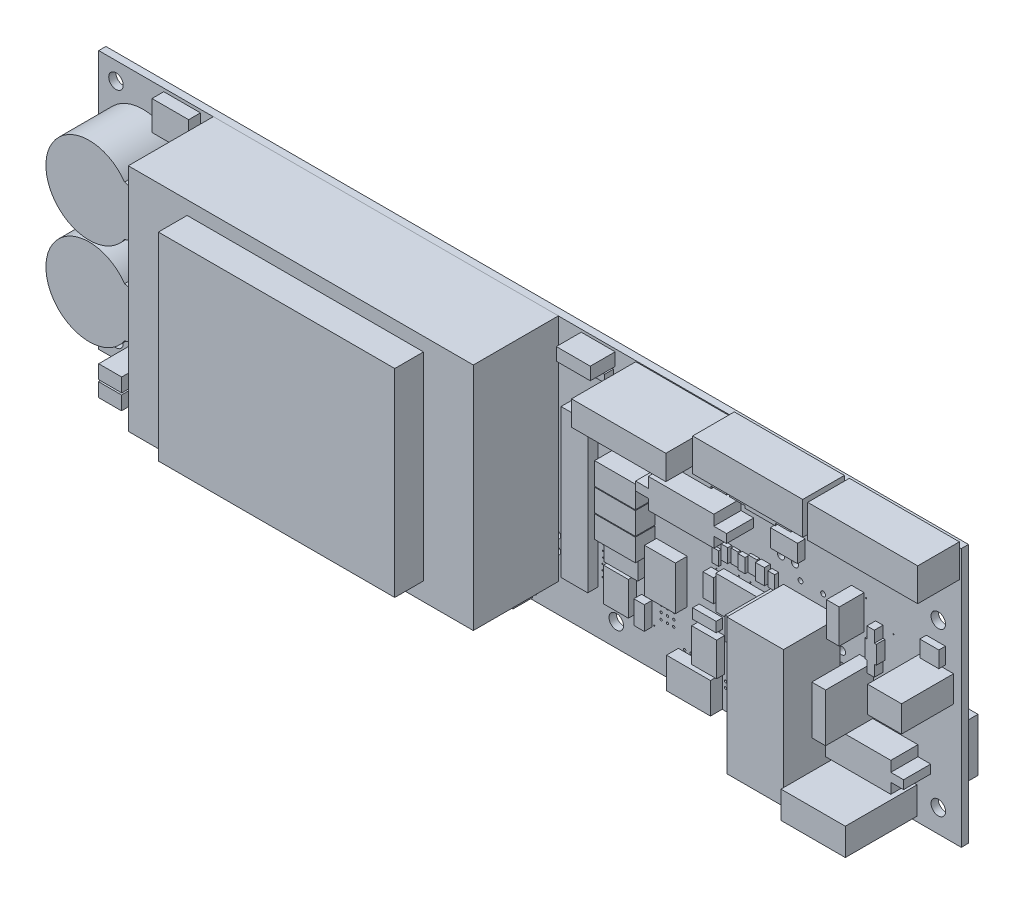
SolidWorks part; units mm, degrees
ref_plane "Front Plane" through (0, 0, 0) normal (0, 0, 1) x (1, 0, 0)
ref_plane "Top Plane" through (0, 0, 0) normal (0, 1, 0) x (1, 0, 0)
ref_plane "Right Plane" through (0, 0, 0) normal (1, 0, 0) x (0, 0, -1)
imported_body "10020446_model8_system_controller-1-solid1"
imported_body "SENSOR_SHT15_SHT11_0_SENSOR_SHT15_SHT15-1-solid1"
imported_body "IND_DO5022P_INDUCTOR_IND_DO5022P_33UH-1-solid1"
imported_body "IND_DO5022P_INDUCTOR_IND_DO5022P_15UH-1-solid1"
imported_body "TATTLETALE_TT8V2_HEADER 110_0_TATTLETALE_TT8V2_-1-solid1"
imported_body "DIOMELF3515N_SOD80_DIODE SCHOTTKY_DIOMELF3515N_SOD-1-solid1"
imported_body "DIOMELF3515N_SOD80_DIODE ZENER_DIOMELF3515N_SOD80_-1-solid1"
imported_body "DIOM7959X262N_DIODE SCHOTTKY_DIOM7959X262N_MB-1-solid1"
imported_body "DIOM7959X262N_DIODE SCHOTTKY_DIOM7959X262N_MB-2-solid1"
imported_body "DIOM7959X262N_DIODE SCHOTTKY_DIOM7959X262N_MB-3-solid1"
imported_body "SOD3717X145N_SOD123_DIODE SCHOTTKY_SOD3717X145N_SOD-1-solid1"
imported_body "SOD3717X145N_SOD123_DIODE SCHOTTKY_SOD3717X145N_SOD-2-solid1"
imported_body "SOD3717X145N_SOD123_DIODE SCHOTTKY_SOD3717X145N_SOD-3-solid1"
imported_body "SAMTEC_CLP12502XD_HEADER 25X2_SAMTEC_CLP12502X-1-solid1"
imported_body "CAPPRD500W80D1250H3000P_HORZ_CAP_CAPPRD500W80D1250H3000P_HOR-1-solid1"
imported_body "RESAD730W47L350D192P_R_RESAD730W47L350D192P_470-1-solid1"
imported_body "RESAD730W47L350D192P_R_RESAD730W47L350D192P_20K-1-solid1"
imported_body "RESAD730W47L350D192P_R_RESAD730W47L350D192P_2K-1-solid1"
imported_body "RESAD730W47L350D192P_R_RESAD730W47L350D192P_2K-2-solid1"
imported_body "RESAD730W47L350D192P_R_RESAD730W47L350D192P_22-1-solid1"
imported_body "RESAD730W47L350D192P_R_RESAD730W47L350D192P_22-2-solid1"
imported_body "RESAD730W47L350D192P_R_RESAD730W47L350D192P_475K-1-solid1"
imported_body "AMP_1034145_HEADER 7_AMP_1034145_AMPMODU_7-1-solid1"
imported_body "SOT95P280X1455N_DBV_MAX6340_SOT95P280X1455N_DBV_MA-1-solid1"
imported_body "SOT95P280X1455N_DBV_74LVC1G79_0_SOT95P280X1455N_DB-1-solid1"
imported_body "SOT190P229X1194N_MAX836_SOT190P229X1194N_MAX836-1-solid1"
imported_body "SOP65P491X1108N_UMAX8_MAX4172_SOP65P491X1108N_UMAX8_-1-solid1"
imported_body "SOT230P700X1804N_LT1121_0_SOT230P700X1804N_LT11-1-solid1"
imported_body "SOT65P280X1008_TS8_MAX6371_SOT65P280X1008_TS8_MAX-1-solid1"
imported_body "DALLASSEMI_DS9094_DS1996_DALLASSEMI_DS9094_DS199-1-solid1"
imported_body "DALLASSEMI_DS9094_DS1994LF5_DALLASSEMI_DS9094_D-1-solid1"
imported_body "TO170P1394X4576N_DD_LT1529_0_TO170P1394X4576N_DD_L-1-solid1"
imported_body "SOIC127P600X17516N_SOIC16_LTC1625_SOIC127P600X17516N_SOI-1-solid1"
imported_body "SOIC127P600X17516N_SOIC16_LTC1625_SOIC127P600X17516N_SOI-2-solid1"
imported_body "SW_FSM2JSMA_SW PUSHBUTTON_SW_FSM2JSMA_FSM2J-1-solid1"
imported_body "SW_FSM2JSMA_SW PUSHBUTTON_SW_FSM2JSMA_FSM2J-2-solid1"
imported_body "SW_FSM2JSMA_SW PUSHBUTTON_SW_FSM2JSMA_FSM2J-3-solid1"
imported_body "SW_FSM2JSMA_SW PUSHBUTTON_SW_FSM2JSMA_FSM2J-4-solid1"
imported_body "RESAD1160W64L616D239P_R_RESAD1160W64L616D239P_887-1-solid1"
imported_body "RESAD1160W64L616D239P_R_RESAD1160W64L616D239P_427K-1-solid1"
imported_body "SENS_CADDOCK_SR10_R_0_SENS_CADDOCK_SR10_001-1-solid1"
imported_body "RESC2013X60N_0805_R_RESC2013X60N_0805_1M-1-solid1"
imported_body "RESC2013X60N_0805_R_RESC2013X60N_0805_1M-2-solid1"
imported_body "RESC2013X60N_0805_R_RESC2013X60N_0805_1M-3-solid1"
imported_body "RESC2013X60N_0805_R_RESC2013X60N_0805_10K-1-solid1"
imported_body "RESC2013X60N_0805_R_RESC2013X60N_0805_10K-2-solid1"
imported_body "RESC2013X60N_0805_R_RESC2013X60N_0805_10K-3-solid1"
imported_body "RESC2013X60N_0805_R_RESC2013X60N_0805_10K-4-solid1"
imported_body "RESC2013X60N_0805_R_RESC2013X60N_0805_100K-1-solid1"
imported_body "RESC2013X60N_0805_R_RESC2013X60N_0805_100K-2-solid1"
imported_body "RESC1608X55N_0603_R_RESC1608X55N_0603_357K-1-solid1"
imported_body "RESC1608X55N_0603_R_RESC1608X55N_0603_392K-1-solid1"
imported_body "RESC1608X55N_0603_R_RESC1608X55N_0603_158K-1-solid1"
imported_body "RESC1608X55N_0603_R_RESC1608X55N_0603_392-1-solid1"
imported_body "SOT95P237X1123N_132_MAX6348_SOT95P237X1123N_132_MA-1-solid1"
imported_body "SOT95P237X1123N_132_MOSFET P GSD_SOT95P237X1123N_1-1-solid1"
imported_body "SOT95P237X1123N_213_MOSFET N DGS_SOT95P237X1123N_2-1-solid1"
imported_body "SOT95P237X1123N_213_MOSFET N DGS_SOT95P237X1123N_2-2-solid1"
imported_body "SOT95P237X1123N_213_MOSFET N DGS_SOT95P237X1123N_2-3-solid1"
imported_body "SOIC127P600X1758N_SOIC8_LTC16931_1_SOIC127P600X1758N_-1-solid1"
imported_body "SOIC127P600X1758N_SOIC8_IRF7210_SOIC127P600X1758N_SOIC-1-solid1"
imported_body "SOIC127P600X1758N_SOIC8_SI4410_SOIC127P600X1758N_SOIC8-1-solid1"
imported_body "SOIC127P600X1758N_SOIC8_SI4410_SOIC127P600X1758N_SOIC8-2-solid1"
imported_body "SOIC127P600X1758N_SOIC8_SI4410_SOIC127P600X1758N_SOIC8-3-solid1"
imported_body "SOIC127P600X1758N_SOIC8_SI4410_SOIC127P600X1758N_SOIC8-4-solid1"
imported_body "SOIC127P600X1758N_SOIC8_SI4410_SOIC127P600X1758N_SOIC8-5-solid1"
imported_body "TP_50055009_51205124_PAD_TP_50055009_51205124_PAD-1-solid1"
imported_body "JWMILLER_FB200103B_INDUCTOR_JWMILLER_FB200103B_FB-1-solid1"
imported_body "JWMILLER_FB200103B_INDUCTOR_JWMILLER_FB200103B_FB-2-solid1"
imported_body "JWMILLER_FB200103B_INDUCTOR_JWMILLER_FB200103B_FB-3-solid1"
imported_body "HDR1X2_HEADER 2_HDR1X2_JUMPER_2-1-solid1"
imported_body "HDR1X2_HEADER 2_HDR1X2_JUMPER_2-2-solid1"
imported_body "HDR1X2_JUMPER_HDR1X2_JMP_SML-1-solid1"
imported_body "HDR1X2_JUMPER_HDR1X2_JMP_SML-2-solid1"
imported_body "HDR1X2_JUMPER_HDR1X2_JMP_SML-3-solid1"
imported_body "PHOENIX_1843240_HEADER 4_PHOENIX_1843240_TERM_B-1-solid1"
imported_body "PHOENIX_1843240_HEADER 4_PHOENIX_1843240_TERM_B-2-solid1"
imported_body "SOIC254P700X2304N_OPTO ISOLATORA_0_SOIC254P700X2-1-solid1"
imported_body "FUSE_1786764_FUSE_FUSE_1786764_5A-1-solid1"
imported_body "TO229P991X610X2393N_DPAK_DIODE DUAL SCHOTTKY_TO229P991X6-1-solid1"
imported_body "CAPRR500W50L720T550H1150P_CAP NP_CAPRR500W50L720T550H1150-1-solid1"
imported_body "CAPRR500W50L720T250H550P_CAP NP_CAPRR500W50L720T250H550P-1-solid1"
imported_body "CAPRR500W50L720T250H550P_CAP NP_CAPRR500W50L720T250H550P-2-solid1"
imported_body "CAPC2013X130N_0805_CAP NP_CAPC2013X130N_0805_01UF-1-solid1"
imported_body "CAPC2013X130N_0805_CAP NP_CAPC2013X130N_0805_01UF-2-solid1"
imported_body "CAPC2013X130N_0805_CAP NP_CAPC2013X130N_0805_01UF-3-solid1"
imported_body "CAPC2013X130N_0805_CAP NP_CAPC2013X130N_0805_22NF-1-solid1"
imported_body "CAPC2013X130N_0805_CAP NP_CAPC2013X130N_0805_22NF-2-solid1"
imported_body "CAPC4532X170N_1812_CAP NP_CAPC4532X170N_1812_10UF-1-solid1"
imported_body "CAPC4532X170N_1812_CAP NP_CAPC4532X170N_1812_10UF-2-solid1"
imported_body "CAPC4532X170N_1812_CAP NP_CAPC4532X170N_1812_10UF-3-solid1"
imported_body "CAPC1608X90N_0603_CAP NP_CAPC1608X90N_0603_220PF-1-solid1"
imported_body "CAPC1608X90N_0603_CAP NP_CAPC1608X90N_0603_220PF-2-solid1"
imported_body "CAPC1608X90N_0603_CAP NP_CAPC1608X90N_0603_220PF-3-solid1"
imported_body "CAPC1608X90N_0603_CAP NP_CAPC1608X90N_0603_220PF-4-solid1"
imported_body "CAPC1608X90N_0603_CAP NP_CAPC1608X90N_0603_220PF-5-solid1"
imported_body "CAPC1608X90N_0603_CAP NP_CAPC1608X90N_0603_220PF-6-solid1"
imported_body "CAPC1608X90N_0603_CAP NP_CAPC1608X90N_0603_470PF-1-solid1"
imported_body "CAPC3216X150N_1206_CAP NP_CAPC3216X150N_1206_033U-1-solid1"
imported_body "CAPC3216X150N_1206_CAP NP_CAPC3216X150N_1206_022U-1-solid1"
imported_body "CAPMP3216X180N_CAP_CAPMP3216X180N_47UF-1-solid1"
imported_body "CAPMP3216X180N_CAP_CAPMP3216X180N_47UF-2-solid1"
imported_body "CAPMP7343X430N_CAP_CAPMP7343X430N_100UF-1-solid1"
imported_body "CAPMP7343X430N_CAP_CAPMP7343X430N_100UF-2-solid1"
imported_body "CAPMP7343X430N_CAP_CAPMP7343X430N_100UF-3-solid1"
imported_body "CAPMP7343X430N_CAP_CAPMP7343X430N_100UF-4-solid1"
imported_body "CAPMP7343X430N_CAP_CAPMP7343X430N_33UF-1-solid1"
imported_body "CAPMP7343X430N_CAP_CAPMP7343X430N_33UF-2-solid1"
imported_body "CAPMP7343X430N_CAP_CAPMP7343X430N_33UF-3-solid1"
imported_body "CAPMP7343X430N_CAP_CAPMP7343X430N_33UF-4-solid1"
imported_body "CAPMP7343X430N_CAP_CAPMP7343X430N_330UF-1-solid1"
imported_body "CAPMP7343X430N_CAP_CAPMP7343X430N_330UF-2-solid1"
imported_body "CAPMP7343X430N_CAP_CAPMP7343X430N_330UF-3-solid1"
sketch "Sketch2" plane through (0, 0, 17.2085) normal (0, 0, 1) x (1, 0, 0)
  line L4 (101.5238, 6.3754) -> (101.5238, 57.1754)
  line L5 (101.5238, 57.1754) -> (25.3238, 57.1754)
  line L6 (25.3238, 57.1754) -> (25.3238, 6.3754)
  line L7 (25.3238, 6.3754) -> (101.5238, 6.3754)
  line L8 (101.5238, 6.3754) -> (101.5238, 57.1754)
  line L9 (101.5238, 57.1754) -> (25.3238, 57.1754)
  line L10 (25.3238, 57.1754) -> (25.3238, 6.3754)
  line L11 (25.3238, 6.3754) -> (101.5238, 6.3754)
  dimension "D1" = 0
extrude "Persistor" add sketch "Sketch2" along normal offset from surface (3.175 mm away) 18.796
sketch "Sketch3" plane through (0, 0, 20.3835) normal (0, 0, 1) x (1, 0, 0)
  line L0 (101.5238, 57.1754) -> (25.3238, 57.1754) construction
  line L1 (25.3238, 57.1754) -> (25.3238, 6.3754) construction
  line L2 (101.5238, 6.3754) -> (101.5238, 57.1754) construction
  line L3 (25.3238, 6.3754) -> (101.5238, 6.3754) construction
  line L8 (38.3238, 10.3754) -> (90.5238, 10.3754)
  line L9 (90.5238, 10.3754) -> (90.5238, 54.1754)
  line L10 (90.5238, 54.1754) -> (38.3238, 54.1754)
  line L11 (38.3238, 54.1754) -> (38.3238, 10.3754)
  dimension "D1" = 3
  dimension "D2" = 13
  dimension "D3" = 11
  dimension "D4" = 4
extrude "MemoryCard" add sketch "Sketch3" along normal blind 6.35
